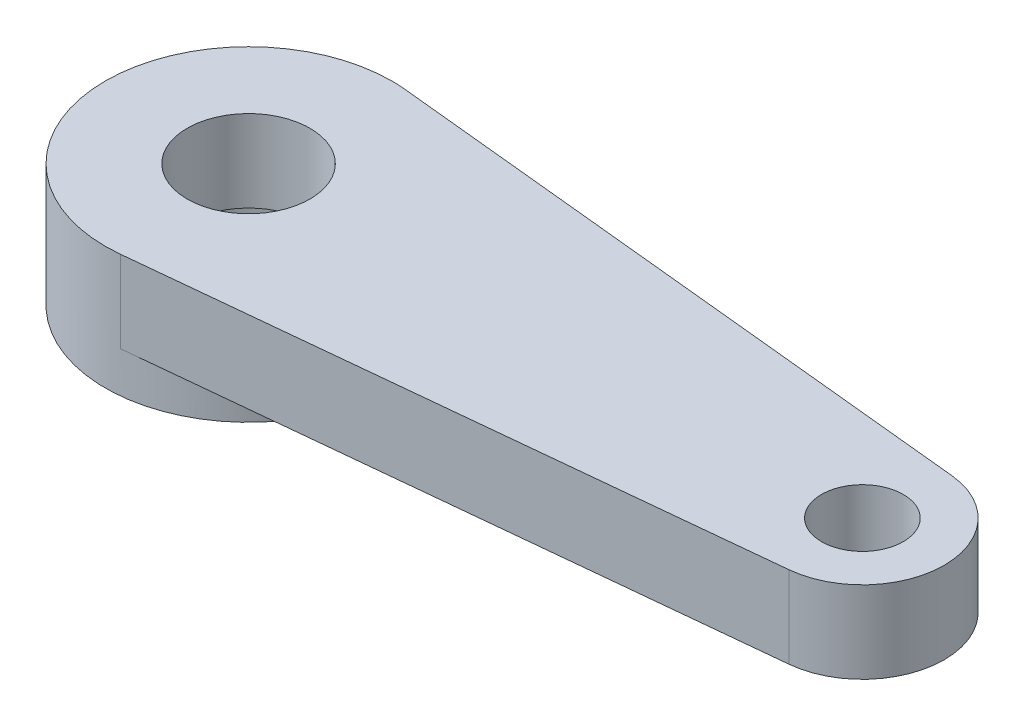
SolidWorks part; units mm, degrees
ref_plane "Front Plane" through (0, 0, 0) normal (0, 0, 1) x (1, 0, 0)
ref_plane "Top Plane" through (0, 0, 0) normal (0, 1, 0) x (1, 0, 0)
ref_plane "Right Plane" through (0, 0, 0) normal (1, 0, 0) x (0, 0, -1)
sketch "Sketch1" plane through (0, 0, 0) normal (0, 1, 0) x (1, 0, 0)
  line L0 (0.35, 3.4825) -> (15.2, 1.99)
  line L1 (0.35, -3.4825) -> (15.2, -1.99)
  circle A0 centre (0, 0) radius 1.5
  circle A1 centre (0, 0) radius 3.5
  circle A2 centre (15, 0) radius 2
  circle A3 centre (15, 0) radius 1
  dimension "D1" = 3
  dimension "D2" = 7
  dimension "D3" = 4
  dimension "D5" = 2
  dimension "D4" = 15
extrude "Boss-Extrude1" add sketch "Sketch1" along normal blind 2 contours A2 L0 A1 L1 | A2 A3 | A1 A0
sketch "Sketch2" plane through (0, 0, 0) normal (0, -1, 0) x (1, 0, 0)
  circle A0 centre (0, 0) radius 3.5
  circle A1 centre (0, 0) radius 2.5
extrude "Boss-Extrude2" add sketch "Sketch2" along normal blind 1
